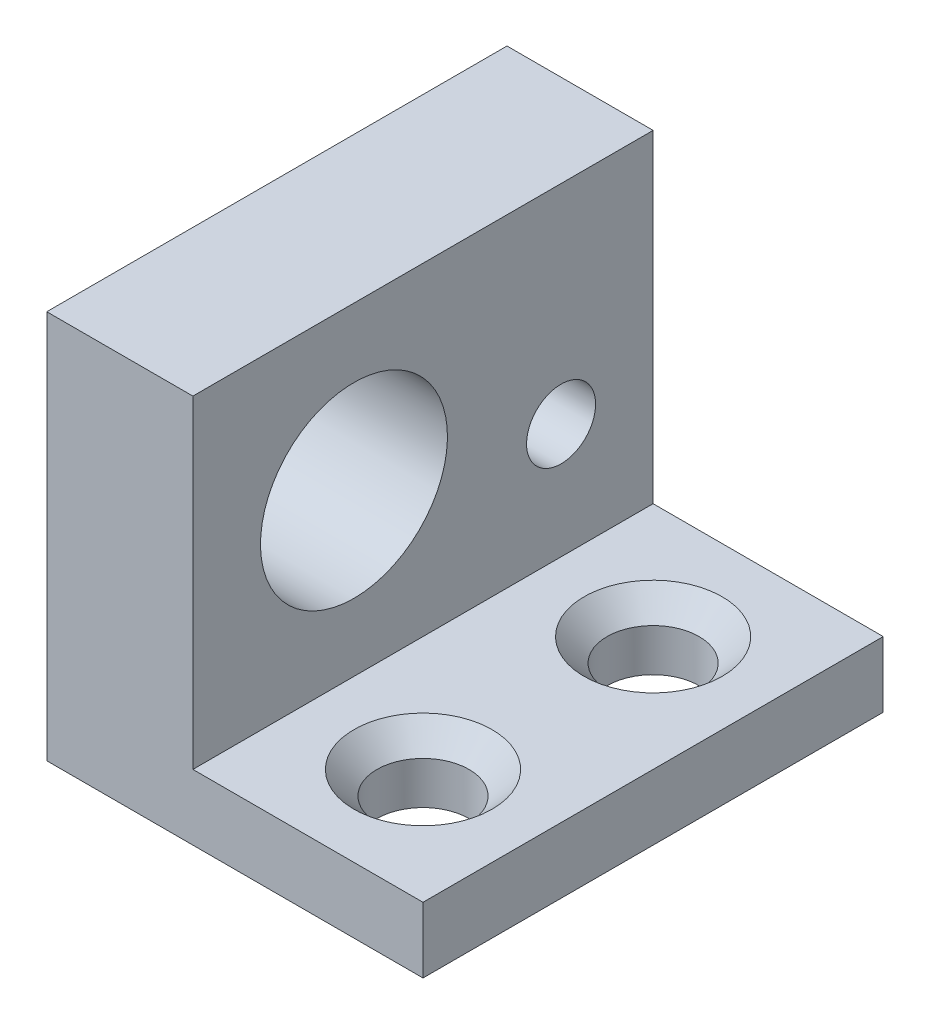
SolidWorks part; units mm, degrees
ref_plane "Front Plane" through (0, 0, 0) normal (0, 0, 1) x (1, 0, 0)
ref_plane "Top Plane" through (0, 0, 0) normal (0, 1, 0) x (1, 0, 0)
ref_plane "Right Plane" through (0, 0, 0) normal (1, 0, 0) x (0, 0, -1)
sketch "Sketch1" plane through (0, 0, 0) normal (0, 0, 1) x (1, 0, 0)
  line L0 (0, 25.4) -> (0, 0)
  line L1 (0, 0) -> (25.4, 0)
  line L2 (25.4, 0) -> (25.4, 6.35)
  line L3 (25.4, 6.35) -> (6.35, 6.35)
  line L4 (6.35, 6.35) -> (6.35, 25.4)
  line L5 (6.35, 25.4) -> (0, 25.4)
  dimension "D1" = 6.35
  dimension "D2" = 25.4
extrude "Boss-Extrude1" add sketch "Sketch1" along normal mid plane 20
sketch "Sketch2" plane through (0, 0, 0) normal (-1, 0, 0) x (0, 0, 1)
  line L0 (0, 0) -> (0, 25.4) construction
  line L1 (10, 25.4) -> (-10, 25.4) construction
  line L2 (10, 25.4) -> (10, 0) construction
  line L3 (-10, 25.4) -> (-10, 0) construction
  circle A0 centre (-6, 11.35) radius 1.5
  circle A1 centre (3, 13.35) radius 4.0625
  dimension "D2" = 8.125
  dimension "D4" = 3
  dimension "D1" = 7
  dimension "D3" = 7
  dimension "D5" = 4
  dimension "D6" = 5
extrude "Cut-Extrude1" cut sketch "Sketch2" against normal up to next
sketch "Sketch4" plane through (0, 0, 0) normal (0, -1, 0) x (1, 0, 0)
  line L1 (0, 10) -> (25.4, 10)
  line L2 (0, 10) -> (0, -10)
  line L3 (0, -10) -> (25.4, -10)
  line L4 (25.4, 10) -> (25.4, -10)
extrude "Cut-Extrude3" cut sketch "Sketch4" against normal blind 3.5
sketch "Sketch5" plane through (0, 25.4, 0) normal (0, 1, 0) x (1, 0, 0)
  line L1 (0, 10) -> (6.35, 10)
  line L2 (0, 10) -> (0, -10)
  line L3 (0, -10) -> (6.35, -10)
  line L4 (6.35, 10) -> (6.35, -10)
extrude "Cut-Extrude4" cut sketch "Sketch5" against normal blind 5
sketch "Sketch6" plane through (0, 0, -10) normal (0, 0, -1) x (-1, 0, 0)
  line L6 (0, 20.4) -> (-6.35, 20.4)
  line L7 (0, 20.4) -> (-6.35, 20.4)
  line L8 (-6.35, 6.35) -> (-25.4, 6.35)
  line L9 (-25.4, 6.35) -> (-25.4, 3.5)
  line L10 (-25.4, 3.5) -> (0, 3.5)
  line L11 (0, 3.5) -> (0, 20.4)
  line L12 (-6.35, 20.4) -> (-6.35, 6.35)
  line L13 (-6.35, 20.4) -> (-6.35, 6.35)
  line L14 (-6.35, 6.35) -> (-25.4, 6.35)
  line L15 (-25.4, 6.35) -> (-25.4, 3.5)
  line L16 (-25.4, 3.5) -> (0, 3.5)
  line L17 (0, 3.5) -> (0, 20.4)
  dimension "D1" = 0
extrude "Boss-Extrude2" [suppressed] add sketch "Sketch6" along normal blind 29.5
sketch "Sketch7" plane through (0, 6.35, 0) normal (0, 1, 0) x (1, 0, 0)
  line L1 (16.35, 44.5) -> (25.4, 44.5)
  line L2 (16.35, 44.5) -> (16.35, -10)
  line L3 (16.35, -10) -> (25.4, -10)
  line L4 (25.4, 44.5) -> (25.4, -10)
  line L5 (6.35, -10) -> (6.35, 10) construction
  dimension "D1" = 10
extrude "Cut-Extrude5" cut sketch "Sketch7" against normal blind 30
sketch "Sketch3" plane through (0, 6.35, 0) normal (0, 1, 0) x (1, 0, 0)
  line L3 (6.35, -10) -> (6.35, 10) construction
  line L4 (16.35, -10) -> (6.35, -10) construction
  line L5 (16.35, 10) -> (6.35, 10) construction
  circle A0 centre (11.35, -5) radius 2
  circle A1 centre (11.35, 5) radius 2
  dimension "D3" = 4
  dimension "D1" = 5
  dimension "D2" = 5
  dimension "D4" = 5
extrude "Cut-Extrude2" cut sketch "Sketch3" against normal up to next
chamfer "Chamfer1" distance 1 angle 45 2 edges at (9.35, 6.35, -5) (9.35, 6.35, 5)
sketch "Sketch8" [suppressed] plane through (0, 0, 0) normal (-1, 0, 0) x (0, 0, 1)
  line L0 (-44.5, 3.5) -> (-44.5, 20.4) construction
  line L1 (-44.5, 14.35) -> (-14, 14.35)
  line L3 (14, 14.35) -> (14, 3.5)
  line L4 (15, 3.5) -> (-44.5, 3.5) construction
  line L5 (14, 3.5) -> (18, 3.5)
  line L6 (18, 3.5) -> (18, 25.4)
  line L7 (18, 25.4) -> (-44.5, 25.4)
  line L8 (-44.5, 25.4) -> (-44.5, 14.35)
  line L9 (15, 20.4) -> (15, 3.5) construction
  line L10 (-44.5, 20.4) -> (15, 20.4) construction
  arc A1 (-14, 14.35) -> (0, 14.35) centre (-7, 14.35) cw
  arc A2 (0, 14.35) -> (14, 14.35) centre (7, 14.35) cw
  dimension "D1" = 7
  dimension "D2" = 3
  dimension "D3" = 5
extrude "Cut-Extrude6" [suppressed] cut sketch "Sketch8" against normal up to next
sketch "Sketch9" [suppressed] plane through (0, 0, 0) normal (-1, 0, 0) x (0, 0, 1)
  line L0 (-14, 20.4) -> (-14, 6.35)
  line L1 (-44.5, 20.4) -> (15, 20.4) construction
  line L2 (-14, 6.35) -> (-34.5, 6.35)
  line L3 (-34.5, 6.35) -> (-34.5, 13.5)
  line L4 (-34.5, 13.5) -> (-44.5, 13.5)
  line L5 (-44.5, 3.5) -> (-44.5, 20.4) construction
  line L6 (-44.5, 13.5) -> (-44.5, 20.4)
  line L7 (-44.5, 20.4) -> (-14, 20.4)
  line L8 (15, 3.5) -> (-44.5, 3.5) construction
  line L9 (15, 6.35) -> (-44.5, 6.35) construction
  circle A0 centre (-7, 14.35) radius 3.175 construction
  dimension "D1" = 7
  dimension "D2" = 10
  dimension "D3" = 10
extrude "Cut-Extrude7" [suppressed] cut sketch "Sketch9" against normal up to next
